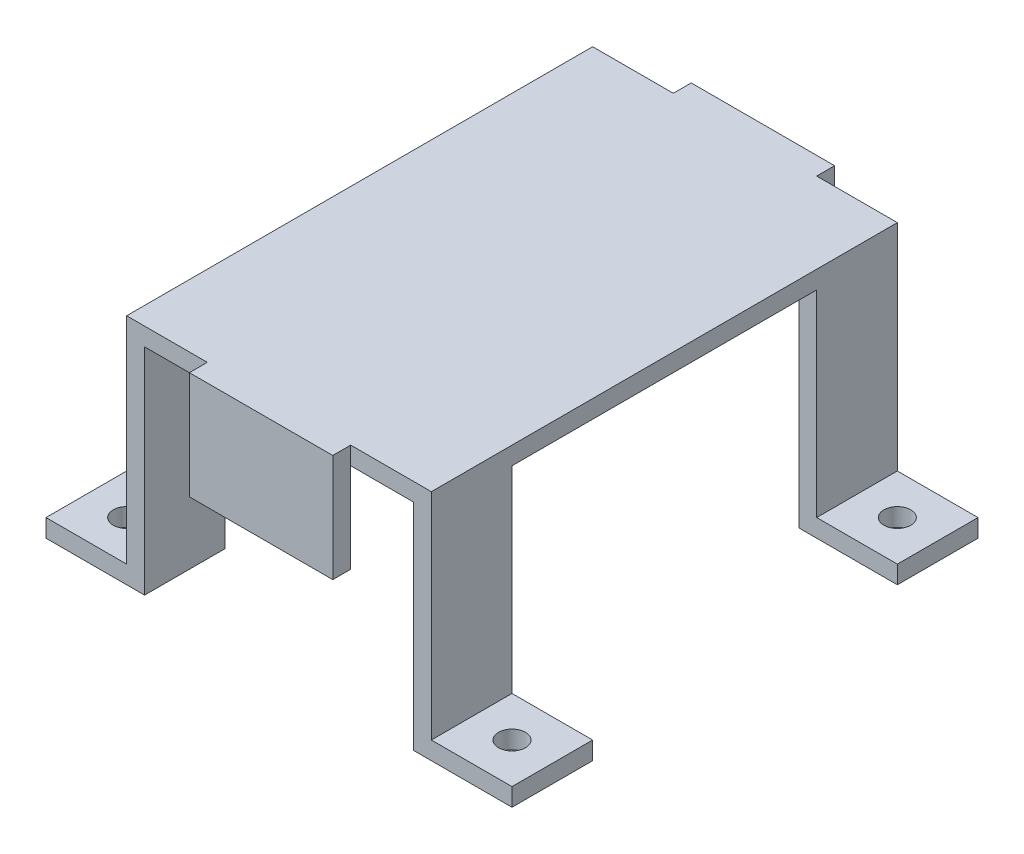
SolidWorks part; units mm, degrees
ref_plane "Front Plane" through (0, 0, 0) normal (0, 0, 1) x (1, 0, 0)
ref_plane "Top Plane" through (0, 0, 0) normal (0, 1, 0) x (1, 0, 0)
ref_plane "Right Plane" through (0, 0, 0) normal (1, 0, 0) x (0, 0, -1)
sketch "Sketch1" plane through (0, 0, 0) normal (0, 1, 0) x (1, 0, 0)
  line L1 (0, 0) -> (52, 0)
  line L2 (0, 0) -> (0, 52)
  line L3 (0, 52) -> (52, 52)
  line L4 (52, 0) -> (52, 52)
  dimension "D1" = 52
  dimension "D2" = 52
extrude "Boss-Extrude2" add sketch "Sketch1" along normal blind 26 contours L3 L4 L1 L2
sketch "Sketch2" plane through (0, 0, 0) normal (0, -1, 0) x (-1, 0, 0)
  line L0 (0, 0) -> (-52, 0) construction
  line L1 (-11, 0) -> (-41, 0)
  line L2 (-11, 0) -> (-11, 52)
  line L3 (-11, 52) -> (-41, 52)
  line L4 (-41, 0) -> (-41, 52)
  line L5 (0, 52) -> (-52, 52) construction
  line L6 (0, 0) -> (0, 52) construction
  dimension "D1" = 11
  dimension "D2" = 11
extrude "Cut-Extrude1" cut sketch "Sketch2" against normal blind 24
sketch "Sketch3" plane through (0, 26, 0) normal (0, 1, 0) x (1, 0, 0)
  line L0 (0, 52) -> (52, 52) construction
  line L1 (52, 0) -> (43, 0)
  line L2 (52, 0) -> (52, 52)
  line L3 (52, 52) -> (43, 52)
  line L4 (43, 0) -> (43, 52)
  line L5 (0, 0) -> (52, 0) construction
  line L6 (0, 52) -> (9, 52)
  line L7 (0, 52) -> (0, 0)
  line L8 (0, 0) -> (9, 0)
  line L9 (9, 52) -> (9, 0)
  dimension "D1" = 9
  dimension "D2" = 9
extrude "Cut-Extrude2" cut sketch "Sketch3" against normal blind 24
sketch "Sketch4" plane through (0, 2, 0) normal (0, 1, 0) x (1, 0, 0)
  line L0 (43, 0) -> (52, 0) construction
  line L1 (43, 52) -> (43, 0) construction
  line L2 (52, 0) -> (52, 52) construction
  line L3 (52, 52) -> (43, 52) construction
  line L4 (0, 52) -> (0, 0) construction
  line L5 (9, 52) -> (0, 52) construction
  line L6 (0, 0) -> (9, 0) construction
  circle A0 centre (47.5, 4.5) radius 1.5
  circle A1 centre (47.5, 47.5) radius 1.5
  circle A2 centre (4.5, 47.5) radius 1.5
  circle A3 centre (4.5, 4.5) radius 1.5
  dimension "D1" = 3
  dimension "D4" = 3
  dimension "D7" = 3
  dimension "D8" = 3
  dimension "D2" = 4.5
  dimension "D3" = 4.5
  dimension "D5" = 4.5
  dimension "D6" = 4.5
  dimension "D9" = 4.5
  dimension "D10" = 4.5
  dimension "D11" = 4.5
  dimension "D12" = 4.5
extrude "Cut-Extrude3" cut sketch "Sketch4" against normal through all
sketch "Sketch5" plane through (52, 0, 0) normal (1, 0, 0) x (0, 0, -1)
  line L0 (0, 0) -> (52, 0) construction
  line L1 (9, 0) -> (43, 0)
  line L2 (9, 0) -> (9, 24)
  line L3 (9, 24) -> (43, 24)
  line L4 (43, 0) -> (43, 24)
  line L5 (0, 2) -> (0, 0) construction
  line L7 (52, 2) -> (52, 0) construction
  point P8 (0, 1)
  dimension "D1" = 9
  dimension "D2" = 9
  dimension "D3" = 24
extrude "Cut-Extrude4" cut sketch "Sketch5" against normal through all
sketch "Sketch6" plane through (0, 0, 0) normal (0, 0, 1) x (1, 0, 0)
  line L0 (9, 26) -> (43, 26) construction
  line L1 (18, 26) -> (34, 26)
  line L2 (18, 26) -> (18, 24)
  line L3 (18, 24) -> (34, 24)
  line L4 (34, 26) -> (34, 24)
  line L5 (41, 24) -> (11, 24) construction
  line L6 (43, 2) -> (43, 26) construction
  line L7 (9, 2) -> (9, 26) construction
  dimension "D1" = 9
  dimension "D2" = 9
extrude "Boss-Extrude3" add sketch "Sketch6" along normal blind 2
sketch "Sketch7" plane through (0, 24, 0) normal (0, -1, 0) x (-1, 0, 0)
  line L1 (-34, 0) -> (-18, 0)
  line L2 (-34, 0) -> (-34, -2)
  line L3 (-34, -2) -> (-18, -2)
  line L4 (-18, 0) -> (-18, -2)
extrude "Boss-Extrude4" add sketch "Sketch7" along normal blind 10
sketch "Sketch8" plane through (0, 0, -52) normal (0, 0, -1) x (-1, 0, 0)
  line L0 (-9, 26) -> (-43, 26) construction
  line L1 (-34, 26) -> (-18, 26)
  line L2 (-34, 26) -> (-34, 24)
  line L3 (-34, 24) -> (-18, 24)
  line L4 (-18, 26) -> (-18, 24)
  line L5 (-11, 24) -> (-41, 24) construction
  line L6 (-43, 2) -> (-43, 26) construction
  line L7 (-9, 2) -> (-9, 26) construction
  dimension "D1" = 9
  dimension "D2" = 9
extrude "Boss-Extrude5" add sketch "Sketch8" along normal blind 2
sketch "Sketch9" plane through (0, 24, 0) normal (0, -1, 0) x (1, 0, 0)
  line L1 (34, -52) -> (18, -52)
  line L2 (34, -52) -> (34, -54)
  line L3 (34, -54) -> (18, -54)
  line L4 (18, -52) -> (18, -54)
extrude "Boss-Extrude6" add sketch "Sketch9" along normal blind 10
